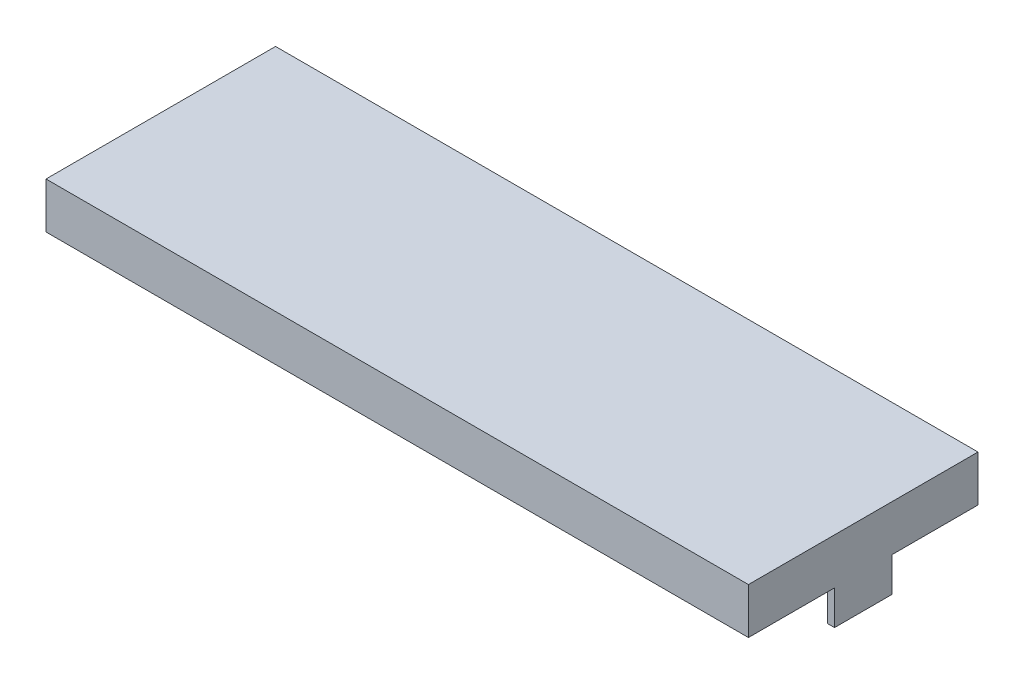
SolidWorks part; units mm, degrees
ref_plane "Front" through (0, 0, 0) normal (0, 0, 1) x (1, 0, 0)
ref_plane "Top" through (0, 0, 0) normal (0, 1, 0) x (1, 0, 0)
ref_plane "Right" through (0, 0, 0) normal (1, 0, 0) x (0, 0, -1)
sketch "Skizze1" plane through (0, 0, 0) normal (0, 0, 1) x (1, 0, 0)
  line L0 (-153, -10) -> (153, 10) construction
  line L1 (-153, -10) -> (153, -10)
  line L2 (-153, -10) -> (-153, 10)
  line L3 (-153, 10) -> (153, 10)
  line L4 (153, -10) -> (153, 10)
  dimension "D1" = 306
  dimension "D2" = 20
extrude "Linear austragen1" add sketch "Skizze1" along normal mid plane 100
sketch "Skizze2" plane through (0, -10, 0) normal (0, -1, 0) x (1, 0, 0)
  line L0 (-153, 50) -> (-153, -50) construction
  line L1 (-153, -12.5) -> (-150, -12.5)
  line L2 (-153, -12.5) -> (-153, 12.5)
  line L3 (-153, 12.5) -> (-150, 12.5)
  line L4 (-150, -12.5) -> (-150, 12.5)
  line L5 (153, 50) -> (153, -50) construction
  line L6 (153, -12.5) -> (150, -12.5)
  line L7 (153, -12.5) -> (153, 12.5)
  line L8 (153, 12.5) -> (150, 12.5)
  line L9 (150, -12.5) -> (150, 12.5)
  line L10 (11, 0) -> (-11, 0) construction
  point P12 (-153, 0)
  dimension "D1" = 3
  dimension "D2" = 25
extrude "Linear austragen2" add sketch "Skizze2" along normal blind 15
